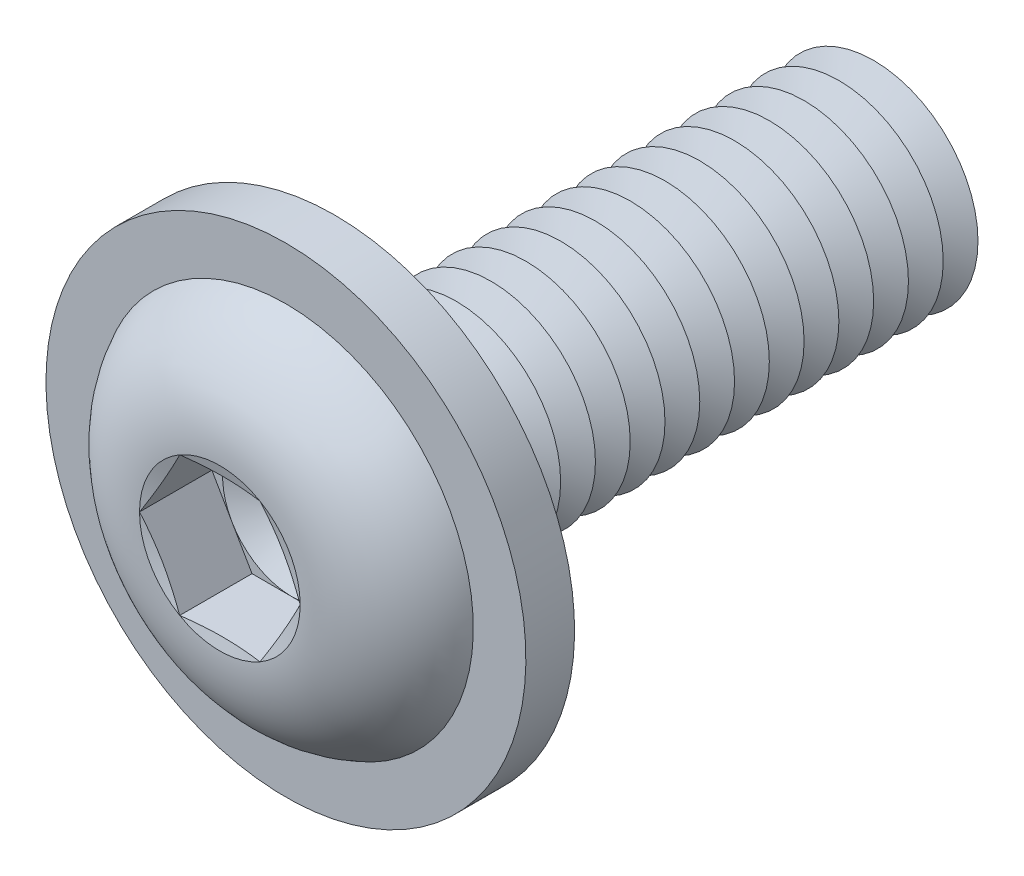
SolidWorks part; units mm, degrees
ref_plane "Front Plane" through (0, 0, 0) normal (0, 0, 1) x (1, 0, 0)
ref_plane "Top Plane" through (0, 0, 0) normal (0, 1, 0) x (1, 0, 0)
ref_plane "Right Plane" through (0, 0, 0) normal (1, 0, 0) x (0, 0, -1)
sketch "Sketch1" plane through (0, 0, 0) normal (1, 0, 0) x (0, 0, -1)
  line L0 (0, 1.5) -> (0, 2.85)
  line L3 (0, 1.5) -> (8, 1.5)
  line L4 (8, 1.5) -> (8, 0)
  line L5 (8, 0) -> (-1.65, 0) construction
  line L6 (-1.65, 0) -> (8, 0)
  line L7 (-1.65, 1.1547) -> (-1.65, 0.5773) construction
  line L8 (-1.65, 0.5773) -> (-1.65, 0)
  line L9 (-1.65, 1.1547) -> (-1.4953, 0.5773)
  line L10 (-1.4953, 0.5773) -> (-1.65, 0.5773)
  line L11 (8, 0) -> (22.7481, 0) construction
  line L12 (0, 2.85) -> (-1.65, 2.85) construction
  arc A1 (0, 2.85) -> (-1.65, 1.1547) centre (0, 1.1994) ccw
  point P8 (8, 0.75)
  dimension "D1" = 5.7
  dimension "D2" = 3
  dimension "D3" = 1.65
  dimension "D4" = 2.3094
  dimension "D5" = 8
  dimension "D6" = 15
revolve "Revolve1" add sketch "Sketch1" angle 360 about L5
fillet "Fillet1" radius 0.25 1 edges at (-1.5, 0, 0)
sketch "Sketch2" plane through (0, 0, 0) normal (1, 0, 0) x (0, 0, -1)
  line L0 (7.75, 1.5) -> (8.25, 1.5)
  line L1 (8, 1.5) -> (0.25, 1.5) construction
  line L2 (8.25, 1.5) -> (8, 1.067)
  line L3 (8, -1.5) -> (8, 1.5) construction
  line L4 (8, 1.067) -> (7.75, 1.5)
  dimension "D1" = 0.5
revolve "Cut-Revolve1" cut sketch "Sketch2" angle 360 about axis through (0, 0, -8) along (0, 0, -1)
pattern_linear "LPattern1" count 16 spacing 0.5 along (0, 0, 1) of "Cut-Revolve1"
sketch "Sketch3" plane through (0, 0, 1.65) normal (0, 0, 1) x (1, 0, 0)
  line L7 (0.5773, 1) -> (-0.5774, 1)
  line L8 (-0.5774, 1) -> (-1.1547, 0)
  line L9 (-1.1547, 0) -> (-0.5773, -1)
  line L10 (-0.5773, -1) -> (0.5773, -1)
  line L11 (0.5773, -1) -> (1.1547, 0)
  line L12 (1.1547, 0) -> (0.5773, 1)
  circle A0 centre (0, 0) radius 1 construction
  circle A3 centre (0, 0) radius 1.1547 construction
extrude "Cut-Extrude1" cut sketch "Sketch3" against normal blind 1.04
sketch "Sketch4" plane through (0, 0, 0.61) normal (0, 0, 1) x (1, 0, 0)
  line L1 (0.5773, 1) -> (-0.5774, 1) construction
  circle A0 centre (0, 0) radius 1
extrude "Cut-Extrude2" cut sketch "Sketch4" against normal through all draft 60
sketch "Sketch5" plane through (0, 0, 0) normal (0, 0, -1) x (-1, 0, 0)
  circle A0 centre (0, 0) radius 3.45
  circle A1 centre (0, 0) radius 1.75
  circle A2 centre (0, 0) radius 1.75 construction
  dimension "D1" = 6.9
extrude "Boss-Extrude1" add sketch "Sketch5" against normal blind 0.7
